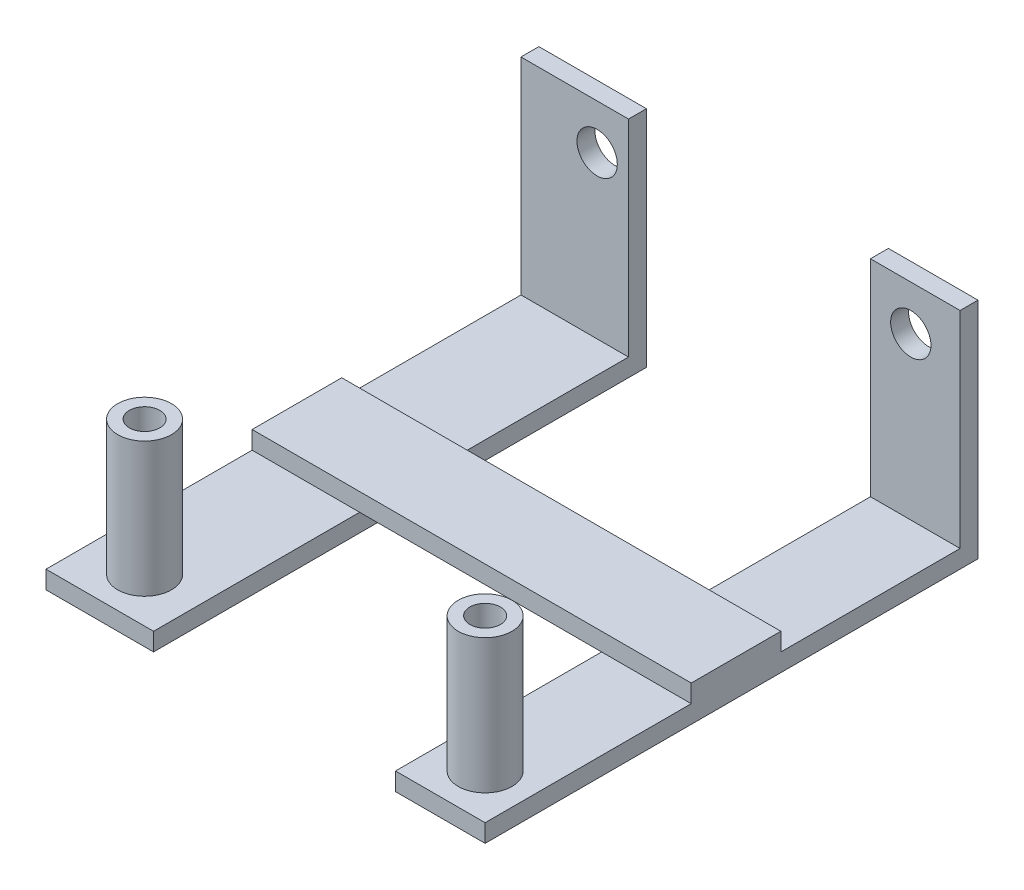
SolidWorks part; units mm, degrees
ref_plane "Piano frontale" through (0, 0, 0) normal (0, 0, 1) x (1, 0, 0)
ref_plane "Piano superiore" through (0, 0, 0) normal (0, 1, 0) x (1, 0, 0)
ref_plane "Piano destro" through (0, 0, 0) normal (1, 0, 0) x (0, 0, -1)
sketch "Schizzo16" plane through (0, 0, 0) normal (0, 1, 0) x (1, 0, 0)
  circle A0 centre (-20, 0) radius 3
  circle A1 centre (18, 0) radius 3
  dimension "D1" = 6
  dimension "D2" = 18
  dimension "D3" = 20
extrude "Estrusione-Estrusione8" add sketch "Schizzo16" along normal blind 15
sketch "Schizzo17" plane through (0, 0, 0) normal (0, -1, 0) x (-1, 0, 0)
  line L1 (26, -5) -> (14, -5)
  line L2 (26, -5) -> (26, 48)
  line L3 (26, 48) -> (14, 48)
  line L4 (14, -5) -> (14, 48)
  line L5 (-13, -5) -> (-23, -5)
  line L6 (-13, -5) -> (-13, 48)
  line L7 (-13, 48) -> (-23, 48)
  line L8 (-23, -5) -> (-23, 48)
  point P8 (20, -5)
  point P10 (-18, -5)
extrude "Estrusione-Estrusione9" add sketch "Schizzo17" along normal blind 2
sketch "Schizzo18" plane through (0, 0, -48) normal (0, 0, -1) x (-1, 0, 0)
  line L1 (-23, -2) -> (-13, -2)
  line L2 (-23, -2) -> (-23, 23)
  line L3 (-23, 23) -> (-13, 23)
  line L4 (-13, -2) -> (-13, 23)
  line L5 (14, -2) -> (26, -2)
  line L6 (14, -2) -> (14, 23)
  line L7 (14, 23) -> (26, 23)
  line L8 (26, -2) -> (26, 23)
  dimension "D1" = 10
  dimension "D3" = 12
  dimension "D4" = 25
extrude "Estrusione-Estrusione10" add sketch "Schizzo18" along normal blind 2
hole_wizard "Foro per Vite M4-4" positions "Schizzo19" profile "Schizzo20" hole size "M4" standard "ISO"
sketch "Schizzo19" plane through (0, 0, -50) normal (0, 0, -1) x (-1, 0, 0)
  line L0 (-13, 23) -> (-23, 23) construction
  point P0 (-17.5, 18)
  point P2 (17.5, 18)
  dimension "D1" = 5
  dimension "D2" = 35
  dimension "D3" = 17.5
sketch "Schizzo20" plane through (17.5, 18, -50) normal (1, 0, 0) x (0, 1, 0)
  line L0 (0, 0) -> (0, 2.001)
  line L1 (0, 2.001) -> (2.25, 2.001)
  line L2 (2.25, 2.001) -> (2.25, 0)
  line L5 (2.25, 0) -> (0, 0)
  line L11 (0, -6.35) -> (0, 107.95) construction
  dimension "Thru Hole Dia." = 4.5
  dimension "Thru Hole Depth" = 2.001
hole_wizard "Foro per Vite M3-2" positions "Schizzo21" profile "Schizzo22" hole size "M3" standard "ISO"
sketch "Schizzo21" plane through (0, 15, 0) normal (0, 1, 0) x (1, 0, 0)
  point P0 (-20, 0)
  point P3 (18, 0)
sketch "Schizzo22" plane through (-20, 15, 0) normal (1, 0, 0) x (0, 0, 1)
  line L0 (0, 0) -> (0, 17)
  line L1 (0, 17) -> (1.7, 17)
  line L2 (1.7, 17) -> (1.7, 0)
  line L5 (1.7, 0) -> (0, 0)
  line L11 (0, -6.35) -> (0, 107.95) construction
  dimension "Thru Hole Dia." = 3.4
  dimension "Thru Hole Depth" = 17
sketch "Schizzo23" plane through (0, 0, 0) normal (0, 1, 0) x (1, 0, 0)
  line L0 (-26, -5) -> (-26, 48) construction
  line L1 (-26, 28) -> (23, 28)
  line L2 (-26, 28) -> (-26, 18)
  line L3 (-26, 18) -> (23, 18)
  line L4 (23, 28) -> (23, 18)
  line L5 (23, 48) -> (23, -5) construction
  line L6 (-26, 48) -> (-14, 48) construction
  dimension "D1" = 10
  dimension "D2" = 20
extrude "Estrusione-Estrusione11" add sketch "Schizzo23" along normal blind 2
equation "\"D8@Schizzo17\"=\"D7@Schizzo17\""
